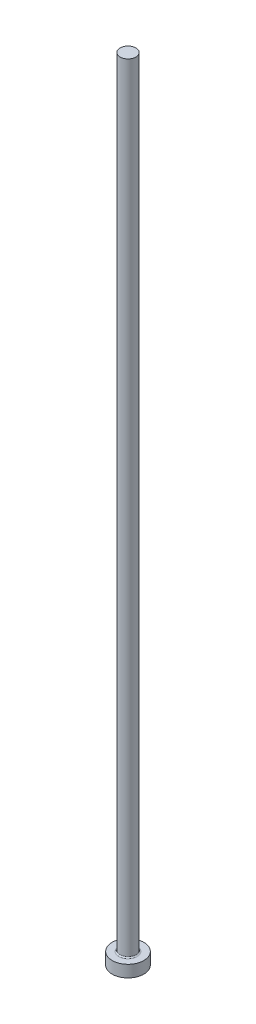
SolidWorks part; units mm, degrees
ref_plane "Plano frontal" through (0, 0, 0) normal (0, 0, 1) x (1, 0, 0)
ref_plane "Plano superior" through (0, 0, 0) normal (0, 1, 0) x (1, 0, 0)
ref_plane "Plano direito" through (0, 0, 0) normal (1, 0, 0) x (0, 0, -1)
sketch "Esboço1" plane through (0, 0, 0) normal (0, 0, 1) x (1, 0, 0)
  line L0 (0, 0) -> (4, 0)
  line L1 (4, 0) -> (4, 3)
  line L2 (4, 3) -> (2.3, 3)
  line L3 (2, 3.3) -> (2, 200)
  line L4 (2, 200) -> (0, 200)
  line L5 (0, 200) -> (0, 0) construction
  line L6 (0, 0) -> (0, 200)
  arc A0 (2.3, 3) -> (2, 3.3) centre (2.3, 3.3) cw
  dimension "D3" = 0.3
  dimension "D1" = 8
  dimension "D2" = 4
  dimension "D4" = 3
  dimension "D5" = 200
revolve "Revolução1" add sketch "Esboço1" angle 360 about L5
sketch "Esboço2"
  dimension "D1" = 0.45
  dimension "D2" = 0.7
  dimension "D3" = 0.3
  dimension "D4" = 2.15
wrap "Envolver1" sketch "Esboço2" wrap type deboss source sketch "Esboço2" thickness 0.1 parameters "D1"=0.1
